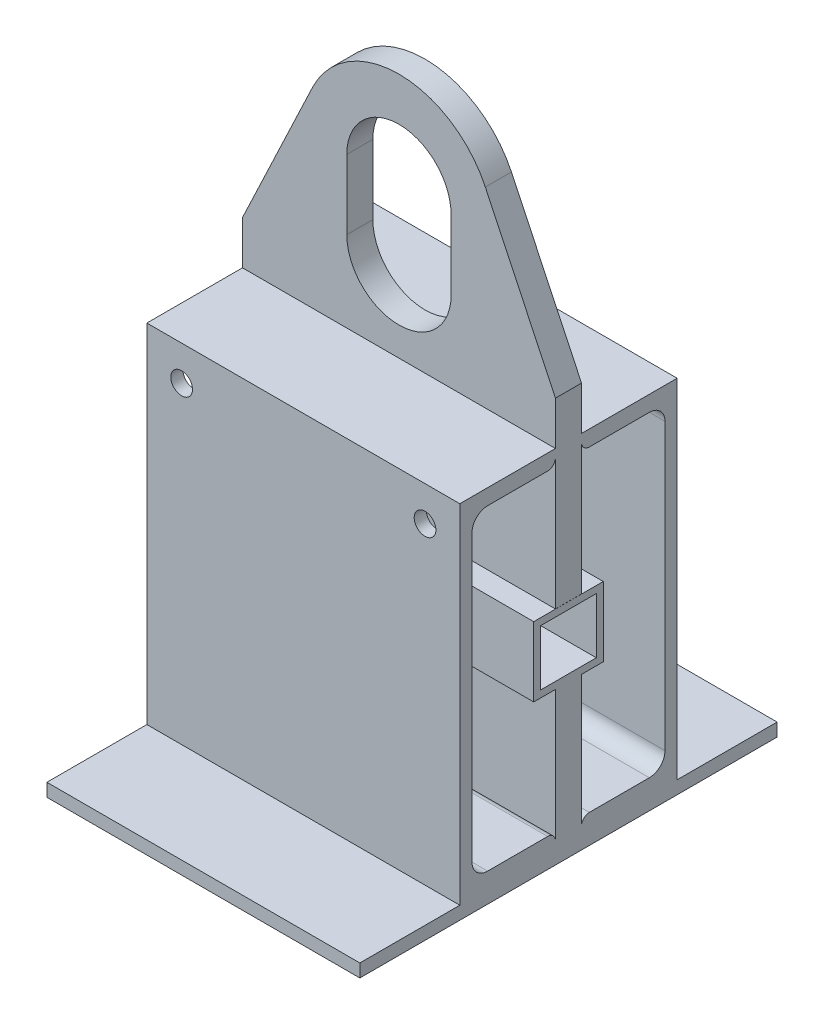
SolidWorks part; units mm, degrees
ref_plane "Plan de face" through (0, 0, 0) normal (0, 0, 1) x (1, 0, 0)
ref_plane "Plan de dessus" through (0, 0, 0) normal (0, 1, 0) x (1, 0, 0)
ref_plane "Plan de droite" through (0, 0, 0) normal (1, 0, 0) x (0, 0, -1)
sketch "Esquisse2" plane through (0, 0, 0) normal (0, 0, 1) x (1, 0, 0)
  line L4 (12.4568, 411.6247) -> (12.4568, 491.6247)
  line L5 (-107.5432, 158.7726) -> (252.4568, 158.7726)
  line L6 (-107.5432, 158.7726) -> (-107.5432, 368.7726)
  line L7 (-107.5432, 368.7726) -> (-26.9339, 538.7573)
  line L8 (252.4568, 158.7726) -> (252.4568, 368.7726)
  line L9 (252.4568, 368.7726) -> (171.8476, 538.7573)
  line L11 (132.4568, 491.6247) -> (132.4568, 411.6247)
  arc A0 (132.4568, 491.6247) -> (12.4568, 491.6247) centre (72.4568, 491.6247) ccw
  arc A1 (171.8476, 538.7573) -> (-26.9339, 538.7573) centre (72.4568, 491.6247) ccw
  arc A2 (12.4568, 411.6247) -> (132.4568, 411.6247) centre (72.4568, 411.6247) ccw
  dimension "D2" = 60
  dimension "D3" = 80
  dimension "D4" = 110
  dimension "D5" = 60
  dimension "D1" = 80
  dimension "D6" = 180
  dimension "D8" = 210
  dimension "D9" = 210
  dimension "D10" = 360
extrude "Boss.-Extru.1" add sketch "Esquisse2" along normal blind 30 contours L9 A1 L7 L6 L5 L8 A2 L4 A0 L11
ref_plane "Plan1" through (-107.5432, 0, 0) normal (-1, 0, 0) x (0, 0, 1)
sketch "Esquisse3" plane through (-107.5432, 0, 0) normal (-1, 0, 0) x (0, 0, 1)
  line L0 (0, 158.7726) -> (0, 368.7726) construction
  line L1 (-25, 158.6293) -> (55, 158.6293)
  line L2 (-25, 158.6293) -> (-25, 78.6293)
  line L3 (-25, 78.6293) -> (55, 78.6293)
  line L4 (55, 158.6293) -> (55, 78.6293)
  line L5 (-17, 150.6293) -> (47, 150.6293)
  line L6 (-17, 150.6293) -> (-17, 86.6293)
  line L7 (-17, 86.6293) -> (47, 86.6293)
  line L8 (47, 150.6293) -> (47, 86.6293)
  line L9 (30, 158.7726) -> (30, 368.7726) construction
  dimension "D1" = 80
  dimension "D2" = 80
  dimension "D3" = 64
  dimension "D4" = 64
  dimension "D5" = 8
  dimension "D6" = 8
  dimension "D7" = 25
  dimension "D8" = 25
extrude "Boss.-Extru.2" add sketch "Esquisse3" against normal blind 360 separate body
ref_plane "Plan2" through (0, 78.6293, 0) normal (0, -1, 0) x (-1, 0, 0)
sketch "Esquisse4" plane through (0, 78.6293, 0) normal (0, -1, 0) x (-1, 0, 0)
  line L0 (107.5432, 25) -> (107.5432, -55) construction
  line L1 (107.5432, -30) -> (-252.4568, -30)
  line L2 (107.5432, -30) -> (107.5432, 0)
  line L3 (107.5432, 0) -> (-252.4568, 0)
  line L4 (-252.4568, -30) -> (-252.4568, 0)
  line L5 (-252.4568, 25) -> (-252.4568, -55) construction
  line L6 (-252.4568, -55) -> (107.5432, -55) construction
  dimension "D1" = 30
  dimension "D2" = 25
extrude "Boss.-Extru.3" add sketch "Esquisse4" along normal blind 160
ref_plane "Plan3" through (0, -81.3707, 0) normal (0, -1, 0) x (-1, 0, 0)
sketch "Esquisse5" plane through (0, -81.3707, 0) normal (0, -1, 0) x (-1, 0, 0)
  line L0 (107.5432, -30) -> (107.5432, 0) construction
  line L1 (107.5432, -255) -> (-252.4568, -255)
  line L2 (107.5432, -255) -> (107.5432, 225)
  line L3 (107.5432, 225) -> (-252.4568, 225)
  line L4 (-252.4568, -255) -> (-252.4568, 225)
  line L7 (-252.4568, -30) -> (107.5432, -30) construction
  dimension "D1" = 360
  dimension "D2" = 480
  dimension "D3" = 360
  dimension "D4" = 225
extrude "Boss.-Extru.4" add sketch "Esquisse5" along normal blind 15
sketch "Esquisse7" plane through (0, 0, 0) normal (1, 0, 0) x (0, 0, -1)
  line L0 (0, 318.6293) -> (110, 318.6293)
  line L1 (0, -81.3707) -> (0, 78.6293) construction
  line L2 (110, 318.6293) -> (110, -81.3707)
  line L3 (-16.5, -81.3707) -> (16.5, -81.3707) construction
  line L4 (110, -81.3707) -> (0, -81.3707)
  line L6 (9, -63.3707) -> (78, -63.3707)
  line L7 (96, -45.3707) -> (96, 282.6293)
  line L8 (78, 300.6293) -> (9, 300.6293)
  line L10 (0, 158.7726) -> (0, 368.7726) construction
  line L11 (0, 318.6293) -> (0, 309.6293)
  line L12 (0, -72.3707) -> (0, -81.3707)
  arc A0 (96, 282.6293) -> (78, 300.6293) centre (78, 282.6293) ccw
  arc A1 (78, -63.3707) -> (96, -45.3707) centre (78, -45.3707) ccw
  arc A2 (0, 309.6293) -> (9, 300.6293) centre (9, 309.6293) ccw
  arc A3 (9, -63.3707) -> (0, -72.3707) centre (9, -72.3707) ccw
  dimension "D6" = 18
  dimension "D7" = 18
  dimension "D8" = 18
  dimension "D10" = 9
  dimension "D1" = 400
  dimension "D2" = 110
  dimension "D3" = 14
  dimension "D4" = 18
  dimension "D5" = 18
  dimension "D11" = 18
extrude "Boss.-Extru.5" add sketch "Esquisse7" against normal up to vertex (107.5432 mm away) and the other way up to vertex (252.4568 mm away)
sketch "Esquisse8" plane through (-107.5432, 0, 0) normal (-1, 0, 0) x (0, 0, 1)
  line L0 (15, 5.8866) -> (15, -42.5331)
  line L1 (0, -72.3707) -> (0, 78.6293) construction
  dimension "D1" = 15
ref_plane "Plan4" through (0, 0, 15) normal (0, 0, 1) x (1, 0, 0)
mirror "Symétrie2" about plane through (0, 0, 15) normal (0, 0, 1) of "Boss.-Extru.5"
ref_plane "Plan5" through (0, 0, 140) normal (0, 0, 1) x (1, 0, 0)
sketch "Esquisse9" plane through (0, 0, 140) normal (0, 0, 1) x (1, 0, 0)
  line L0 (-107.5432, 318.6293) -> (252.4568, 318.6293) construction
  line L1 (-107.5432, 318.6293) -> (252.4568, 318.6293) construction
  line L3 (252.4568, -81.3707) -> (252.4568, 318.6293) construction
  line L4 (-107.5432, 255.8288) -> (-107.5432, -255.8288) construction
  circle A0 centre (212.4568, 278.6293) radius 12.5
  circle A1 centre (-67.5432, 278.6293) radius 12.5
  point P10 (252.4568, 262.2374)
  dimension "D1" = 25
  dimension "D2" = 25
  dimension "D3" = 40
  dimension "D4" = 40
  dimension "D5" = 40
  dimension "D6" = 40
extrude "Enlèv. mat.-Extru.1" cut sketch "Esquisse9" against normal blind 20 contours A1 | A0
mirror "Symétrie3" about plane through (0, 0, 15) normal (0, 0, 1) of "Enlèv. mat.-Extru.1"
